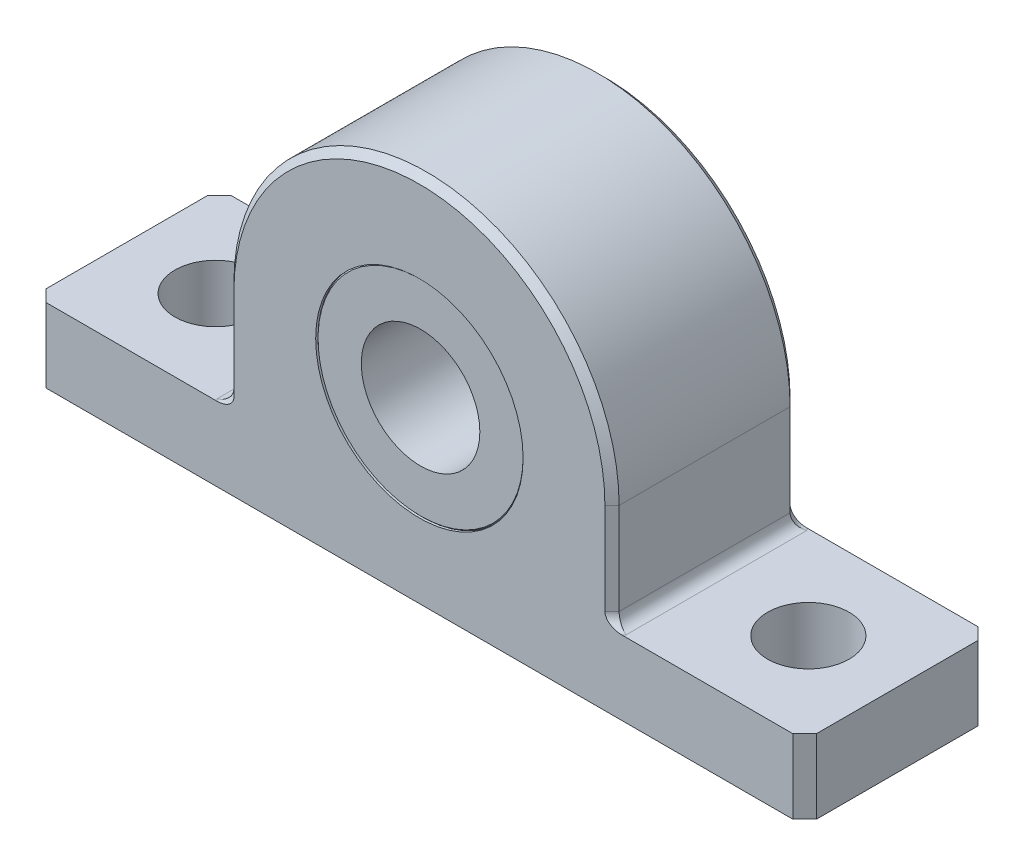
SolidWorks part; units mm, degrees
ref_plane "Front" through (0, 0, 0) normal (0, 0, 1) x (1, 0, 0)
ref_plane "Top" through (0, 0, 0) normal (0, 1, 0) x (1, 0, 0)
ref_plane "Right" through (0, 0, 0) normal (1, 0, 0) x (0, 0, -1)
sketch "Sketch1" plane through (0, 0, 0) normal (0, 0, 1) x (1, 0, 0)
  line L0 (-20.6375, 0) -> (-20.6375, -11.1125)
  line L1 (-20.6375, -11.1125) -> (-41.275, -11.1125)
  line L2 (-41.275, -11.1125) -> (-41.275, -19.05)
  line L3 (-41.275, -19.05) -> (41.275, -19.05)
  line L4 (41.275, -19.05) -> (41.275, -11.1125)
  line L5 (41.275, -11.1125) -> (20.6375, -11.1125)
  line L6 (20.6375, -11.1125) -> (20.6375, 0)
  line L7 (0, 0) -> (0, -19.05) construction
  arc A0 (20.6375, 0) -> (-20.6375, 0) centre (0, 0) ccw
  dimension "length" = 82.55
  dimension "vert centerline" = 19.05
  dimension "foot height" = 7.9375
  dimension "height" = 39.6875
extrude "Extrude1" add sketch "Sketch1" along normal mid plane 19.8438
chamfer "Chamfer1" distance 0.762 angle 45 6 edges at (-20.6375, -5.5562, -9.9219) (0, 20.6375, -9.9219) (20.6375, -5.5562, -9.9219) (-20.6375, -5.5562, 9.9219) (20.6375, -5.5562, 9.9219) (0, 20.6375, 9.9219)
fillet "Fillet1" radius 1.27 6 edges at (-20.6375, -11.1125, 0) (20.6375, -11.1125, 0) (20.2565, -11.1125, -9.5409) (20.2565, -11.1125, 9.5409) (-20.2565, -11.1125, -9.5409) (-20.2565, -11.1125, 9.5409)
chamfer "Chamfer2" distance 1.27 angle 45 4 edges at (-41.275, -15.0813, -9.9219) (-41.275, -15.0813, 9.9219) (41.275, -15.0812, -9.9219) (41.275, -15.0812, 9.9219)
sketch "Sketch3" plane through (0, 0, 0) normal (0, 0, 1) x (1, 0, 0)
  circle A0 centre (0, 0) radius 11.1125
  dimension "thru dia" = 22.225
extrude "Cut-Extrude1" cut sketch "Sketch3" against normal through all and the other way through all
sketch "Sketch4" plane through (0, 0, 0) normal (1, 0, 0) x (0, 0, -1)
  line L0 (-8.8978, 0) -> (9.9548, 0) construction
  line L1 (55, 0) -> (-55, 0) construction
  line L2 (-9.7949, 0) -> (-9.7949, 10.9855)
  line L3 (9.9219, 11.1125) -> (-9.9219, 11.1125) construction
  line L4 (-9.6679, 11.1125) -> (-8.5249, 11.1125)
  line L5 (-9.7949, 10.9855) -> (-9.6679, 11.1125)
  line L6 (-8.5249, 11.1125) -> (-8.5249, 10.9855)
  line L7 (-8.5249, 10.9855) -> (9.9219, 10.9855)
  line L8 (9.9219, 0) -> (9.9219, 19.8755) construction
  line L9 (9.9219, 10.9855) -> (9.9219, 0)
  line L10 (9.9219, 0) -> (-9.7949, 0)
  line L11 (-9.9219, 19.8755) -> (-9.9219, 0) construction
  dimension "D1" = 0.127
  dimension "D2" = 21.971
  dimension "D3" = 1.27
  dimension "D4" = 135
  dimension "D5" = 0.127
revolve "Revolve1" add sketch "Sketch4" angle 360 about L0
sketch "Sketch5" plane through (0, 0, 0) normal (0, 0, 1) x (1, 0, 0)
  circle A0 centre (0, 0) radius 6.35
  dimension "shaft" = 12.7
extrude "Cut-Extrude2" cut sketch "Sketch5" against normal through all and the other way through all
sketch "Sketch6" plane through (0, 0, 0) normal (0, 1, 0) x (1, 0, 0)
  line L0 (-30.0221, 0) -> (29.6861, 0) construction
  line L1 (0, 7.1755) -> (0, -6.5996) construction
  circle A0 centre (-31.75, 0) radius 4.3656
  circle A1 centre (31.75, 0) radius 4.3656
  dimension "hole dia" = 8.7312
  dimension "hole centers" = 63.5
extrude "Cut-Extrude3" cut sketch "Sketch6" against normal through all
equation "\"D2@Sketch4\"=\"thru dia@Sketch3\"-.010"
